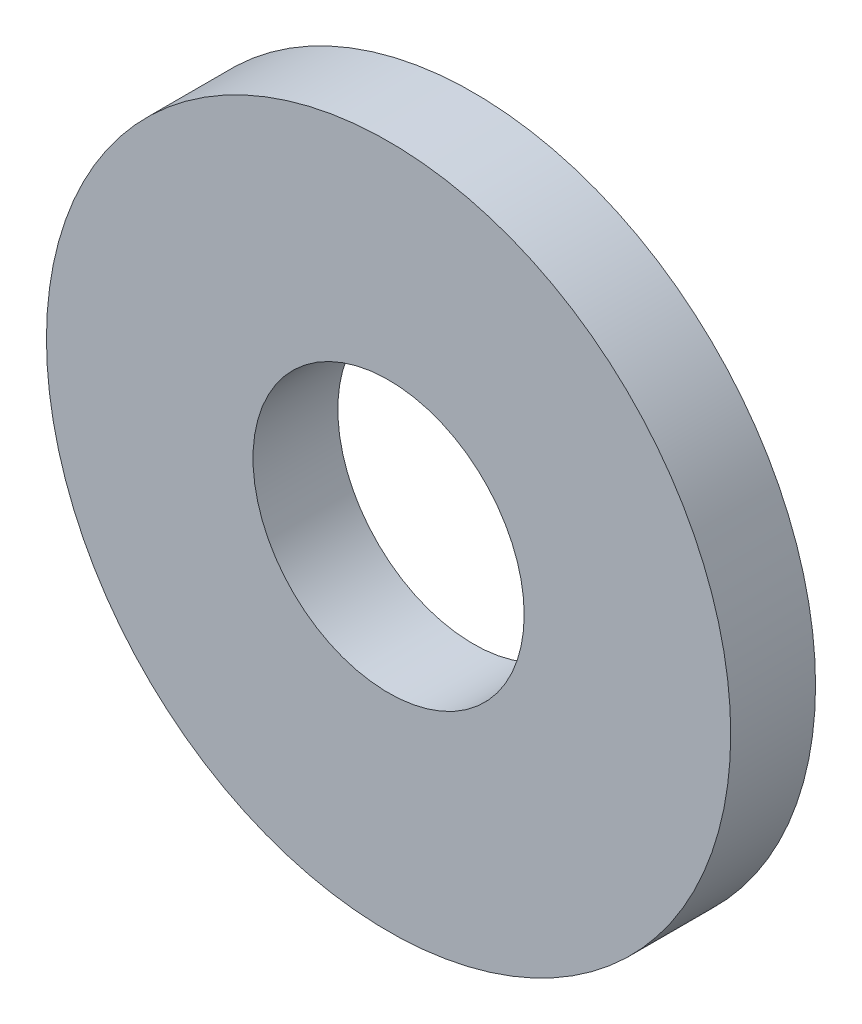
SolidWorks part; units mm, degrees
ref_plane "Plan de face" through (0, 0, 0) normal (0, 0, 1) x (1, 0, 0)
ref_plane "Plan de dessus" through (0, 0, 0) normal (0, 1, 0) x (1, 0, 0)
ref_plane "Plan de droite" through (0, 0, 0) normal (1, 0, 0) x (0, 0, -1)
sketch "Esquisse1" plane through (0, 0, 0) normal (0, 0, 1) x (1, 0, 0)
  circle A0 centre (38.3796, 299.3938) radius 8.0677
  circle A1 centre (38.3796, 299.3938) radius 3.1973
extrude "Boss.-Extru.1" add sketch "Esquisse1" along normal blind 2
